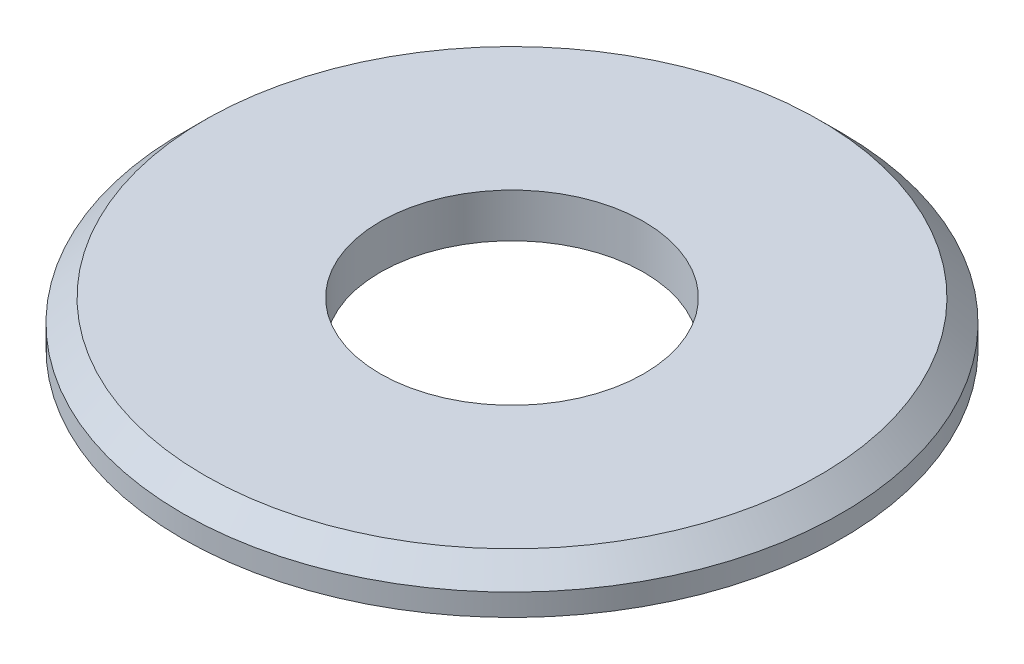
SolidWorks part; units mm, degrees
ref_plane "Front" through (0, 0, 0) normal (0, 0, 1) x (1, 0, 0)
ref_plane "Top" through (0, 0, 0) normal (0, 1, 0) x (1, 0, 0)
ref_plane "Right" through (0, 0, 0) normal (1, 0, 0) x (0, 0, -1)
sketch "Sketch1" plane through (0, 0, 0) normal (0, 1, 0) x (1, 0, 0)
  circle A0 centre (0, 0) radius 0.9
  circle A1 centre (0, 0) radius 2.25
extrude "Extrude1" add sketch "Sketch1" along normal blind 0.3
chamfer "Chamfer1" distance 0.15 1 edges at (0, 0.3, 2.25)
